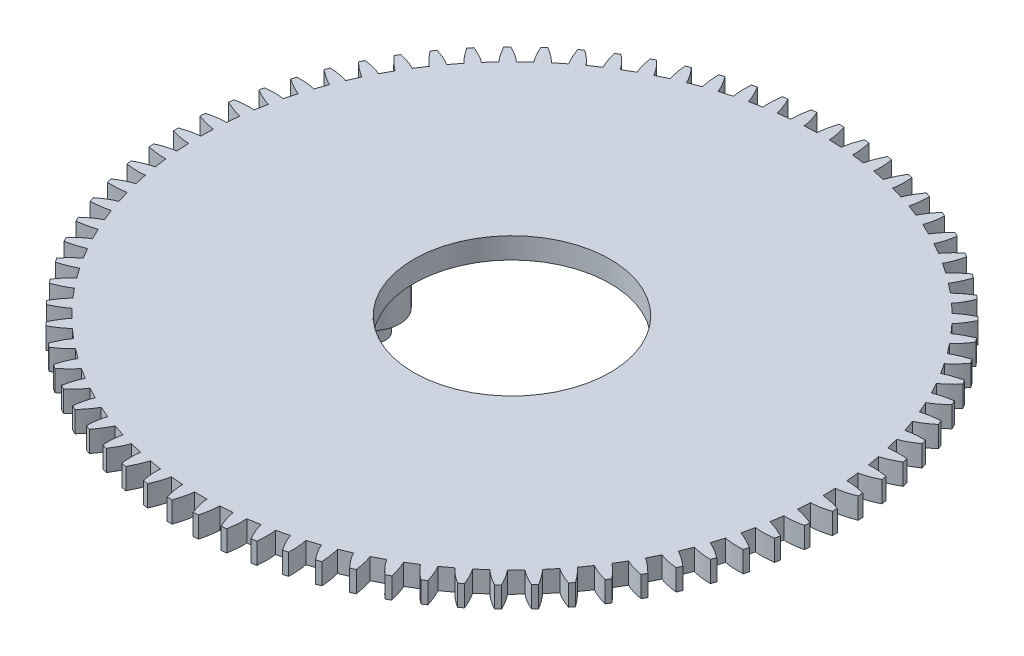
SolidWorks part; units mm, degrees
ref_plane "Front Plane" through (0, 0, 0) normal (0, 0, 1) x (1, 0, 0)
ref_plane "Top Plane" through (0, 0, 0) normal (0, 1, 0) x (1, 0, 0)
ref_plane "Right Plane" through (0, 0, 0) normal (1, 0, 0) x (0, 0, -1)
sketch "Sketch1" plane through (0, 0, 0) normal (0, 1, 0) x (1, 0, 0)
  line L0 (0, 0) -> (0, 22.1803) construction
  line L1 (0, 0) -> (-22.1803, 0) construction
  line L2 (0, 0) -> (-23.4854, -0.467) construction
  line L3 (0, 0) -> (-22.1627, -0.8818) construction
  line L4 (0, 0) -> (-22.1101, -1.7622) construction
  circle A0 centre (0, 0) radius 22.91 construction
  circle A1 centre (0, 0) radius 22.1803 construction
  circle A2 centre (0, 0) radius 22.185 construction
  circle A3 centre (0, 0) radius 23.49 construction
  spline S0 degree 4 poles (-22.1803, 0) (-22.2152, 0) (-22.3129, -0.0036) (-22.4971, -0.0245) (-22.7948, -0.0787) (-23.1684, -0.1766) (-23.6423, -0.336) (-24.1867, -0.565) (-24.7673, -0.8589) (-25.3771, -1.2223) (-25.964, -1.6229) (-26.5273, -2.0557) (-27.0675, -2.5172) (-27.6949, -3.1082) (-28.4088, -3.8644) (-29.1823, -4.8052) (-29.9842, -5.9473) (-30.7151, -7.1663) (-31.3619, -8.4319) (-31.8561, -9.5729) (-32.2297, -10.5709) (-32.5083, -11.4136) (-32.7119, -12.0944) (-32.9424, -12.9508) (-33.1416, -13.8178) (-33.2929, -14.5997) (-33.4066, -15.3042) (-33.4825, -15.8255) (-33.5502, -16.3672) (-33.6056, -16.8718) (-33.6522, -17.4379) (-33.6872, -17.9152) (-33.7173, -18.5232) (-33.7319, -18.9378) (-33.7444, -19.6781) (-33.7383, -20.1833) (-33.7295, -20.6901) (-33.7172, -20.9451) (-33.7114, -21.1099) knots 0 0 0 0 0 0.005377 0.015084 0.028532 0.04661 0.064855 0.092111 0.119476 0.146842 0.174209 0.201575 0.228941 0.256307 0.307035 0.361767 0.4165 0.471232 0.525964 0.580697 0.608063 0.635429 0.662795 0.690161 0.744894 0.77226 0.785943 0.799626 0.826992 0.854358 0.868042 0.881725 0.909091 0.931818 0.954545 0.977273 1 1 1 1 1 construction
  spline S1 degree 4 poles (-22.1803, 0) (-22.2152, 0) (-22.3129, -0.0036) (-22.4971, -0.0245) (-22.7948, -0.0787) (-23.1684, -0.1766) (-23.6423, -0.336) (-24.1867, -0.565) (-24.7673, -0.8589) (-25.3771, -1.2223) (-25.964, -1.6229) (-26.5273, -2.0557) (-27.0675, -2.5172) (-27.6949, -3.1082) (-28.4088, -3.8644) (-29.1823, -4.8052) (-29.9842, -5.9473) (-30.7151, -7.1663) (-31.3619, -8.4319) (-31.8561, -9.5729) (-32.2297, -10.5709) (-32.5083, -11.4136) (-32.7119, -12.0944) (-32.9424, -12.9508) (-33.1416, -13.8178) (-33.2929, -14.5997) (-33.4066, -15.3042) (-33.4825, -15.8255) (-33.5502, -16.3672) (-33.6056, -16.8718) (-33.6522, -17.4379) (-33.6872, -17.9152) (-33.7085, -18.3448) (-33.7186, -18.5862) (-33.724, -18.7475) knots 0 0 0 0 0 0.005377 0.015084 0.028532 0.04661 0.064855 0.092111 0.119476 0.146842 0.174209 0.201575 0.228941 0.256307 0.307035 0.361767 0.4165 0.471232 0.525964 0.580697 0.608063 0.635429 0.662795 0.690161 0.744894 0.77226 0.785943 0.799626 0.826992 0.854358 0.868042 0.881725 0.909091 0.909091 0.909091 0.909091 0.909091
  dimension "D1" = 46.98
  dimension "D2" = 45.82
  dimension "D3" = 44.3605
  dimension "D4" = 44.37
  dimension "D5" = 22.1803
  dimension "D6" = 1.139
  dimension "D7" = 2.278
  dimension "D8" = 4.557
sketch "Sketch2" plane through (0, 0, 0) normal (0, 1, 0) x (1, 0, 0)
  line L0 (0, 0) -> (-23.4854, -0.467) construction
  line L1 (0, 0) -> (-23.4854, -0.467) construction
  line L2 (0, 0) -> (-22.1627, -0.8818) construction
  line L3 (0, 0) -> (-22.1803, 0) construction
  line L4 (0, 0) -> (-22.1101, -1.7622) construction
  line L5 (0, 0) -> (-22.1627, -0.8818) construction
  line L6 (0, 0) -> (-22.1803, 0) construction
  line L7 (0, 0) -> (-22.1101, -1.7622) construction
  line L8 (-22.185, 0) -> (-22.1675, -0.882) construction
  line L9 (-22.1675, -0.882) -> (-22.1149, -1.7626)
  line L10 (-22.1149, -1.7626) -> (-22.1101, -1.7622) construction
  line L11 (-22.1149, -1.7626) -> (-6.9779, -0.5562)
  line L12 (-22.1803, 0) -> (-7, 0)
  circle A0 centre (0, 0) radius 22.185 construction
  circle A1 centre (0, 0) radius 22.1803 construction
  circle A2 centre (0, 0) radius 22.91 construction
  circle A3 centre (0, 0) radius 23.49 construction
  circle A4 centre (0, 0) radius 22.185 construction
  circle A5 centre (0, 0) radius 22.1803 construction
  circle A6 centre (0, 0) radius 22.91 construction
  circle A7 centre (0, 0) radius 23.49 construction
  arc A8 (-23.4811, -0.6459) -> (-23.4882, -0.2881) centre (0, 0) cw
  circle A11 centre (0, 0) radius 7 construction
  arc A12 (-7, 0) -> (-6.9779, -0.5562) centre (0, 0) ccw
  spline S2 degree 4 poles (-22.1675, -0.882) (-22.1761, -0.8816) (-22.2736, -0.8768) (-22.4937, -0.856) (-22.8244, -0.8058) (-23.1427, -0.7358) (-23.3718, -0.6763) (-23.4811, -0.6459) knots 0.004428 0.004428 0.004428 0.004428 0.004428 0.005377 0.015084 0.028532 0.040915 0.040915 0.040915 0.040915 0.040915
  spline S3 degree 4 poles (-47.8598, -999.618) (-17.4256, -28.1469) (-18.7527, -0.6531) (-20.8189, 0.2807) (-22.7948, -0.0787) (-23.1684, -0.1766) (-23.6423, -0.336) (-24.1867, -0.565) (-24.7673, -0.8589) (-25.3771, -1.2223) (-25.964, -1.6229) (-26.5273, -2.0557) (-27.0675, -2.5172) (-27.6949, -3.1082) (-28.4088, -3.8644) (-29.1823, -4.8052) (-29.9842, -5.9473) (-30.7151, -7.1663) (-31.3619, -8.4319) (-31.8561, -9.5729) (-32.2297, -10.5709) (-32.5083, -11.4136) (-32.7119, -12.0944) (-32.9424, -12.9508) (-33.1416, -13.8178) (-33.2929, -14.5997) (-33.4066, -15.3042) (-33.4825, -15.8255) (-33.5502, -16.3672) (-33.6056, -16.8718) (-33.6522, -17.4379) (-33.8057, -19.5326) (-33.8735, -25.5907) (-31.6437, 32.2674) (-66.1391, -1018.1428) knots -0.262806 -0.262806 -0.262806 -0.262806 -0.262806 0.005377 0.015084 0.028532 0.04661 0.064855 0.092111 0.119476 0.146842 0.174209 0.201575 0.228941 0.256307 0.307035 0.361767 0.4165 0.471232 0.525964 0.580697 0.608063 0.635429 0.662795 0.690161 0.744894 0.77226 0.785943 0.799626 0.826992 0.854358 0.868042 0.881725 1.187316 1.187316 1.187316 1.187316 1.187316 only from (-22.1803, 0) to (-33.724, -18.7475) construction
  spline S4 degree 4 poles (-22.1803, 0) (-22.2152, 0) (-22.3129, -0.0036) (-22.4971, -0.0245) (-22.7948, -0.0787) (-23.0865, -0.1552) (-23.3138, -0.2271) (-23.4564, -0.2768) (-23.4882, -0.2881) knots 0 0 0 0 0 0.005377 0.015084 0.028532 0.04661 0.051817 0.051817 0.051817 0.051817 0.051817
  point P18 (-22.1762, -0.441)
  point P24 (-22.1149, -1.7626)
  dimension "D2" = 14
extrude "Boss-Extrude1" add sketch "Sketch2" along normal blind 1.5
pattern_circular "CirPattern1" count 79 over 360 of "Boss-Extrude1"
sketch "Sketch3" plane through (0, 0, 0) normal (0, -1, 0) x (-1, 0, 0)
  circle A0 centre (10, 0) radius 1
  dimension "D1" = 2
  dimension "D2" = 10
extrude "Boss-Extrude2" add sketch "Sketch3" along normal blind 4.5 contours A0
sketch "Sketch4" plane through (0, 0, 0) normal (0, -1, 0) x (1, 0, 0)
  circle A0 centre (-10, 0) radius 2
  dimension "D1" = 4
extrude "Boss-Extrude3" add sketch "Sketch4" along normal blind 3 contours A0
equation "\"Module\"= .58"
equation "\"Number of Teeth\"= 79"
equation "\"Pressure Angle\"= 14.5deg"
equation "\"Pitch Diameter\"= \"Number of Teeth\" * \"Module\""
equation "\"Circular Pitch\"= pi * \"Module\""
equation "\"Addendum\"= \"Module\""
equation "\"Dedendum\"= 1.25 * \"Module\""
equation "\"Base Diameter\"= \"Pitch Diameter\" * cos ( \"Pressure Angle\" )"
equation "\"Base Radius\"= \"Base Diameter\" / 2"
equation "\"Width\"= 1.5mm"
equation "\"Outside Diameter\"= \"Pitch Diameter\" + 2 * \"Addendum\""
equation "\"D1@Sketch1\"=\"Outside Diameter\""
equation "\"D3@Sketch1\"=\"Base Diameter\""
equation "\"Root Diameter\"= \"Pitch Diameter\" - 2 * \"Dedendum\""
equation "\"D4@Sketch1\"=\"Root Diameter\""
equation "\"Tooth Angle\"= 360 / \"Number of Teeth\""
equation "\"D6@Sketch1\"=\"Tooth Angle\"/4"
equation "\"D7@Sketch1\"=\"Tooth Angle\"/2"
equation "\"D8@Sketch1\"=\"Tooth Angle\""
equation "\"D2@Sketch1\" = \"Pitch Diameter\""
equation "\"Shaft Diameter\"= 14"
equation "\"D1@CirPattern1\" = \"Number of Teeth\""
equation "\"D2@Sketch2\"  = \"Shaft Diameter\""
equation "\"D1@Boss-Extrude1\" = \"Width\""
